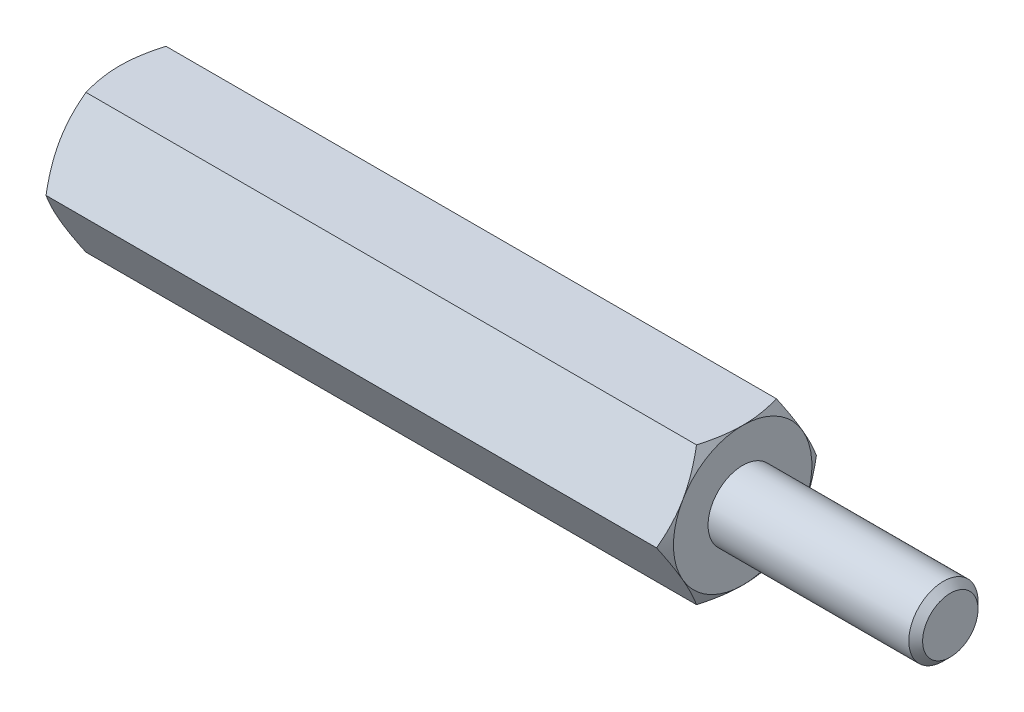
SolidWorks part; units mm, degrees
ref_plane "Front Plane" through (0, 0, 0) normal (0, 0, 1) x (1, 0, 0)
ref_plane "Top Plane" through (0, 0, 0) normal (0, 1, 0) x (1, 0, 0)
ref_plane "Right Plane" through (0, 0, 0) normal (1, 0, 0) x (0, 0, -1)
sketch "Sketch1" plane through (0, 0, 0) normal (1, 0, 0) x (0, 0, -1)
  line L1 (1.1547, 2) -> (-1.1547, 2)
  line L2 (-1.1547, 2) -> (-2.3094, 0)
  line L3 (-2.3094, 0) -> (-1.1547, -2)
  line L4 (-1.1547, -2) -> (1.1547, -2)
  line L5 (1.1547, -2) -> (2.3094, 0)
  line L6 (2.3094, 0) -> (1.1547, 2)
  circle A0 centre (0, 0) radius 2 construction
  dimension "D1" = 4
extrude "Extrude2" add sketch "Sketch1" along normal mid plane 18
sketch "Sketch2" plane through (0, 0, 0) normal (0, 0, 1) x (1, 0, 0)
  line L0 (-9, 2) -> (-7.5, 4.5981)
  line L1 (-9, 5) -> (-9, 2)
  line L3 (0, 0) -> (50000, 0) construction
  arc A0 (-7.5, 4.5981) -> (-9, 5) centre (-8.1962, 5) ccw
  dimension "D1" = 30
  dimension "D2" = 3
revolve "Cut-Revolve1" cut sketch "Sketch2" angle 360 about L3
mirror "Mirror1" about plane through (0, 0, 0) normal (1, 0, 0) of "Cut-Revolve1"
sketch "Sketch3" plane through (-9, 0, 0) normal (-1, 0, 0) x (0, 0, 1)
  circle A0 centre (0, 0) radius 0.8
  dimension "D1" = 1.6
extrude "Extrude3" cut sketch "Sketch3" against normal blind 6
sketch "Sketch4" plane through (0, 0, 0) normal (0, 0, 1) x (1, 0, 0)
  line L0 (-3, 0) -> (-3, 0.8)
  line L1 (8.8214, 0) -> (-8.8214, 0) construction
  line L2 (-3, 0.8) -> (-2.5381, 0)
  line L3 (-2.5381, 0) -> (-3, 0)
  line L4 (-9, 1) -> (-9, -1) construction
  point P4 (-9, 0)
  dimension "D1" = 30
  dimension "D2" = 0.8
  dimension "D3" = 6
revolve "Cut-Revolve2" cut sketch "Sketch4" angle 360 about L3
sketch "Sketch5" plane through (9, 0, 0) normal (1, 0, 0) x (0, 0, -1)
  circle A0 centre (0, 0) radius 1
  dimension "D1" = 2
extrude "Extrude4" add sketch "Sketch5" along normal blind 6
chamfer "Chamfer1" distance 0.2 angle 45 1 edges at (15, 0, -1)
equation "\"D2@Sketch4\" = \"D1@Sketch3\"/2"
